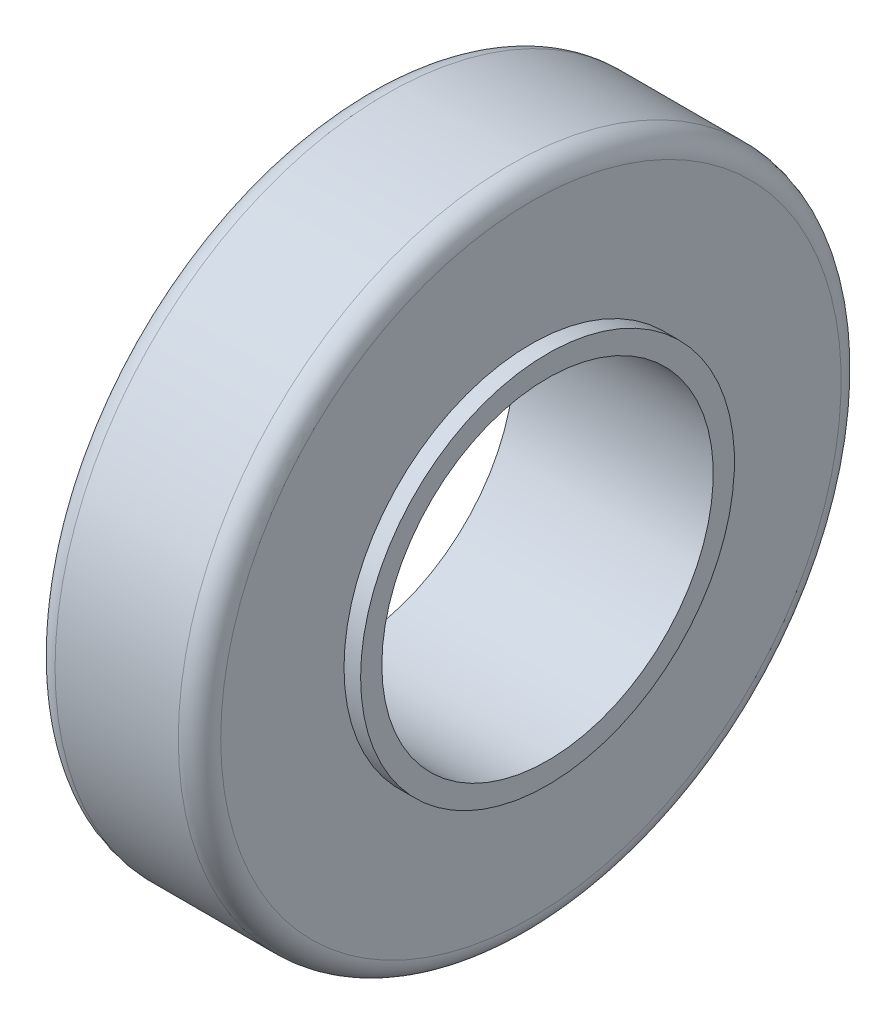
SolidWorks part; units mm, degrees
ref_plane "Front Plane" through (0, 0, 0) normal (0, 0, 1) x (1, 0, 0)
ref_plane "Top Plane" through (0, 0, 0) normal (0, 1, 0) x (1, 0, 0)
ref_plane "Right Plane" through (0, 0, 0) normal (1, 0, 0) x (0, 0, -1)
sketch "Sketch1" plane through (0, 0, 0) normal (0, 0, 1) x (1, 0, 0)
  line L0 (0, 0) -> (23.2829, 0) construction
  line L1 (-2.3813, 3.9688) -> (2.3813, 3.9688)
  line L2 (2.3813, 3.9688) -> (2.3813, 4.4768)
  line L3 (2.3813, 4.4768) -> (1.9837, 4.4768)
  line L4 (1.9837, 4.4768) -> (1.9837, 7.9375)
  line L5 (1.9837, 7.9375) -> (-1.9837, 7.9375)
  line L6 (-1.9837, 7.9375) -> (-1.9837, 4.4768)
  line L7 (-1.9837, 4.4768) -> (-2.3813, 4.4768)
  line L8 (-2.3813, 4.4768) -> (-2.3813, 3.9688)
  line L9 (0, 0) -> (0, 7.9375) construction
  dimension "D1" = 7.9375
  dimension "D2" = 0.508
  dimension "D3" = 15.875
  dimension "D4" = 3.9675
  dimension "D5" = 4.7625
revolve "Revolve1" add sketch "Sketch1" angle 360 about L0
fillet "Fillet1" radius 0.508 2 edges at (-1.9837, 0, 7.9375) (1.9837, 0, 7.9375)
